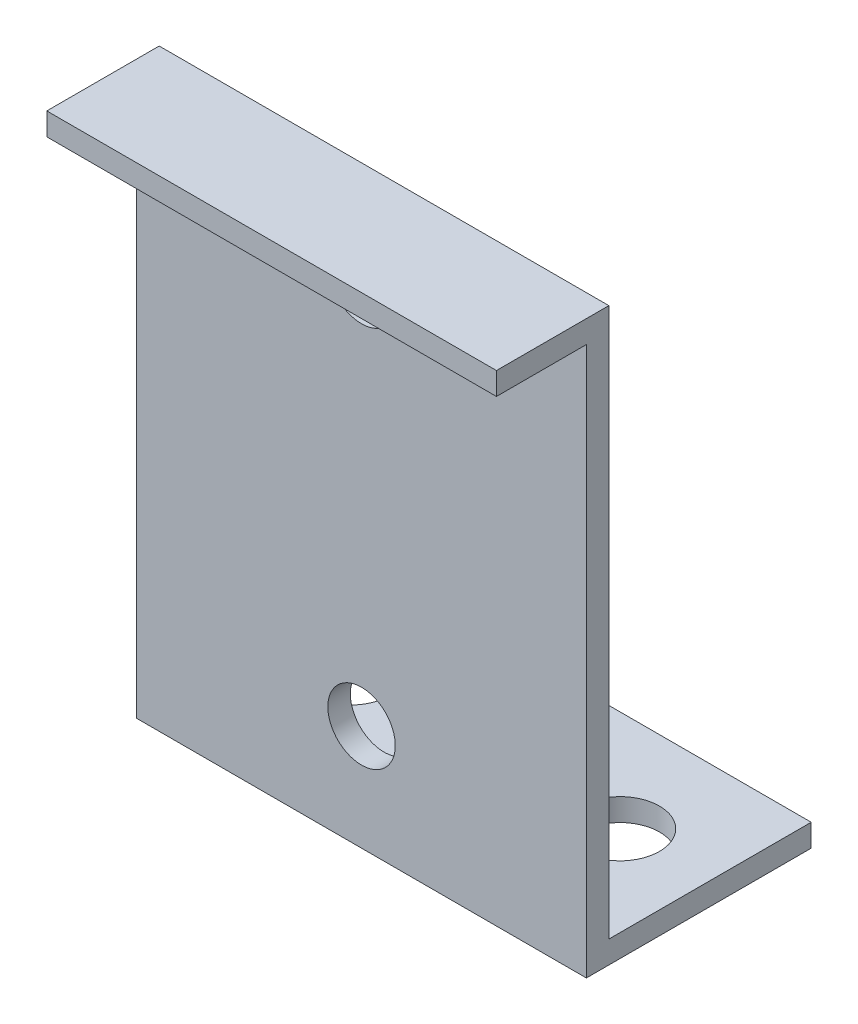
SolidWorks part; units mm, degrees
ref_plane "Front Plane" through (0, 0, 0) normal (0, 0, 1) x (1, 0, 0)
ref_plane "Top Plane" through (0, 0, 0) normal (0, 1, 0) x (1, 0, 0)
ref_plane "Right Plane" through (0, 0, 0) normal (1, 0, 0) x (0, 0, -1)
sketch "Sketch1" plane through (0, 0, 0) normal (1, 0, 0) x (0, 0, -1)
  line L0 (10, 0) -> (0, 0)
  line L1 (0, 0) -> (0, 24.4)
  line L2 (0, 24.4) -> (-4, 24.4)
  line L3 (10, 1) -> (1, 1)
  line L4 (1, 1) -> (1, 25.4)
  line L5 (1, 25.4) -> (-4, 25.4)
  line L6 (-4, 25.4) -> (-4, 24.4)
  line L7 (10, 1) -> (10, 0)
  dimension "D2" = 10
  dimension "D3" = 5
  dimension "D4" = 24.4
  dimension "D1" = 1
extrude "Extrude1" add sketch "Sketch1" along normal blind 20
sketch "Sketch2" plane through (0, 1, 0) normal (0, 1, 0) x (1, 0, 0)
  line L0 (20, 5.5) -> (0, 5.5) construction
  line L3 (10, 1) -> (10, 10) construction
  line L4 (20, 1) -> (0, 1) construction
  line L5 (20, 10) -> (0, 10) construction
  line L6 (20, 10) -> (20, 1) construction
  line L7 (0, 10) -> (0, 1) construction
  circle A0 centre (4, 5.5) radius 1.75
  circle A1 centre (16, 5.5) radius 1.75
  dimension "D1" = 12
  dimension "D2" = 3.5
  dimension "D3" = 6
extrude "Extrude2" cut sketch "Sketch2" against normal blind 20
sketch "Sketch3" plane through (0, 0, -1) normal (0, 0, -1) x (-1, 0, 0)
  line L0 (-10, 1) -> (-10, 25.4) construction
  line L1 (-20, 1) -> (0, 1) construction
  line L2 (-20, 25.4) -> (0, 25.4) construction
  line L3 (-20, 13.2) -> (0, 13.2) construction
  line L4 (-20, 1) -> (-20, 25.4) construction
  line L5 (0, 1) -> (0, 25.4) construction
  circle A0 centre (-10, 21.7) radius 1.5
  circle A1 centre (-10, 4.7) radius 1.5
  dimension "D1" = 17
  dimension "D2" = 3
  dimension "D3" = 3
  dimension "D4" = 8.5
extrude "Extrude3" cut sketch "Sketch3" against normal blind 20
